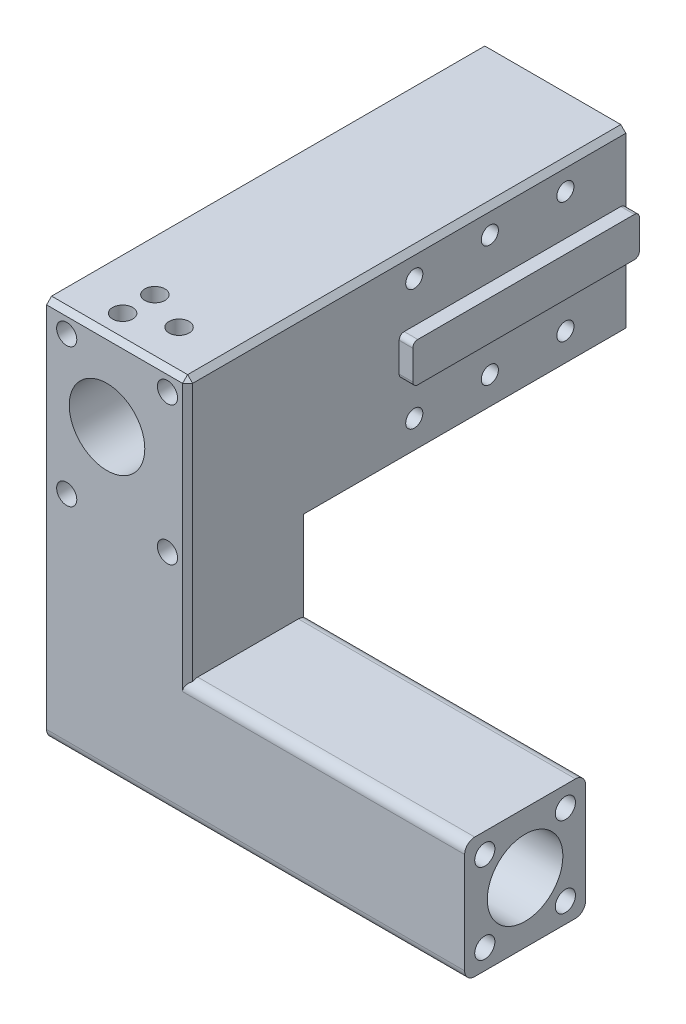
SolidWorks part; units mm, degrees
ref_plane "Ebene vorne" through (0, 0, 0) normal (0, 0, 1) x (1, 0, 0)
ref_plane "Ebene oben" through (0, 0, 0) normal (0, 1, 0) x (1, 0, 0)
ref_plane "Ebene rechts" through (0, 0, 0) normal (1, 0, 0) x (0, 0, -1)
sketch "Skizze1" plane through (0, 0, 0) normal (0, 1, 0) x (1, 0, 0)
  line L1 (-14, -43.5) -> (14, -43.5)
  line L2 (-14, -43.5) -> (-14, 43.5)
  line L3 (-14, 43.5) -> (14, 43.5)
  line L4 (14, -43.5) -> (14, 43.5)
  line L5 (-14, -43.5) -> (14, 43.5) construction
  line L6 (-14, 43.5) -> (14, -43.5) construction
  point P0 (0, 0)
  dimension "D1" = 87
  dimension "D2" = 28
extrude "Aufsatz-Linear austragen1" add sketch "Skizze1" along normal mid plane 100.5
hole_wizard "Ø15.0 (15) Durchmesser Bohrung2" positions "Skizze4" profile "Skizze5" hole size "Ø15.0" standard "DIN"
sketch "Skizze4" plane through (14, 0, 0) normal (1, 0, 0) x (0, 0, -1)
  line L0 (-43.5, -50.25) -> (43.5, -50.25) construction
  line L1 (-43.5, 50.25) -> (-43.5, -50.25) construction
  point P0 (-31.5, -38.25)
  dimension "D1" = 12
  dimension "D2" = 12
sketch "Skizze5" plane through (14, -38.25, 31.5) normal (0, 1, 0) x (0, 0, -1)
  line L0 (0, 0) -> (0, 28)
  line L1 (0, 28) -> (7.5, 28)
  line L2 (7.5, 28) -> (7.5, 0)
  line L5 (7.5, 0) -> (0, 0)
  line L11 (0, -6.35) -> (0, 107.95) construction
  dimension "Bohrerdurchmesser" = 15
  dimension "Bohrungstiefe" = 28
hole_wizard "Ø15.0 (15) Durchmesser Bohrung1" positions "Skizze2" profile "Skizze3" hole size "Ø15.0" standard "DIN"
sketch "Skizze2" plane through (0, 0, 43.5) normal (0, 0, 1) x (1, 0, 0)
  line L0 (-14, 50.25) -> (-14, -50.25) construction
  line L1 (-14, -50.25) -> (14, -50.25) construction
  point P0 (-2, 9.75)
  dimension "D1" = 60
  dimension "D2" = 12
sketch "Skizze3" plane through (-2, 9.75, 43.5) normal (1, 0, 0) x (0, -1, 0)
  line L0 (0, 0) -> (0, 87)
  line L1 (0, 87) -> (7.5, 87)
  line L2 (7.5, 87) -> (7.5, 0)
  line L5 (7.5, 0) -> (0, 0)
  line L11 (0, -6.35) -> (0, 107.95) construction
  dimension "Bohrerdurchmesser" = 15
  dimension "Bohrungstiefe" = 87
sketch "Skizze9" plane through (0, 0, 43.5) normal (0, 0, 1) x (1, 0, 0)
  line L0 (-14, 50.25) -> (-14, -50.25) construction
  line L1 (14, 50.25) -> (4, 50.25)
  line L2 (14, 50.25) -> (14, 35.25)
  line L3 (14, 35.25) -> (4, 35.25)
  line L4 (4, 50.25) -> (4, 35.25)
  dimension "D1" = 15
  dimension "D2" = 18
extrude "Schnitt-Linear austragen1" cut sketch "Skizze9" against normal through all
sketch "Skizze11" plane through (14, 0, 0) normal (1, 0, 0) x (0, 0, -1)
  line L0 (-43.5, -50.25) -> (43.5, -50.25) construction
  line L1 (43.5, -9.75) -> (-19.5, -9.75)
  line L2 (43.5, -9.75) -> (43.5, -50.25)
  line L3 (43.5, -50.25) -> (-19.5, -50.25)
  line L4 (-19.5, -9.75) -> (-19.5, -50.25)
  line L5 (-43.5, 35.25) -> (-43.5, -50.25) construction
  line L7 (43.5, 35.25) -> (43.5, -50.25) construction
  line L8 (43.5, 50.25) -> (-43.5, 50.25) construction
  line L9 (-35.5, 50.25) -> (43.5, 50.25)
  line L10 (-35.5, 50.25) -> (-35.5, 25.75)
  line L11 (-35.5, 25.75) -> (43.5, 25.75)
  line L12 (43.5, 50.25) -> (43.5, 25.75)
  line L13 (-43.5, 50.25) -> (-43.5, 35.25) construction
  dimension "D1" = 24
  dimension "D2" = 40.5
  dimension "D3" = 24.5
  dimension "D4" = 8
extrude "Schnitt-Linear austragen3" cut sketch "Skizze11" against normal through all
hole_wizard "Stirnsenkung für M3 Zylinderschraube mit Innensechskant1" positions "Skizze12" profile "Skizze13" counterbore size "M3" standard "DIN"
sketch "Skizze12" plane through (-14, 0, 0) normal (-1, 0, 0) x (0, 0, 1)
  line L1 (-43.5, 25.75) -> (-43.5, -9.75) construction
  line L2 (35.5, 25.75) -> (-43.5, 25.75) construction
  point P0 (-31.5, -3.25)
  point P2 (-31.5, 20.75)
  point P4 (-16.5, 20.75)
  point P6 (-16.5, -3.25)
  point P8 (-1.5, -3.25)
  point P10 (-1.5, 20.75)
  dimension "D1" = 5
  dimension "D2" = 24
  dimension "D3" = 12
  dimension "D4" = 15
  dimension "D5" = 15
sketch "Skizze13" plane through (-14, -3.25, -31.5) normal (0, 1, 0) x (0, 0, 1)
  line L0 (0, 0) -> (0, 28)
  line L1 (0, 28) -> (1.7, 28)
  line L3 (1.7, 28) -> (1.7, 3.4)
  line L4 (1.7, 3.4) -> (3.25, 3.4)
  line L5 (3.25, 3.4) -> (3.25, 0)
  line L7 (3.25, 0) -> (0, 0)
  line L11 (0, -6.35) -> (0, 107.95) construction
  dimension "Bohrerdurchmesser" = 3.4
  dimension "Bohrungstiefe" = 28
  dimension "Senkdurchmesser2" = 6.5
  dimension "Senktiefe2" = 3.4
sketch "Skizze14" plane through (14, 0, 0) normal (1, 0, 0) x (0, 0, -1)
  line L0 (-19.5, -9.75) -> (-19.5, -50.25) construction
  line L1 (-43.5, -50.25) -> (-19.5, -50.25)
  line L2 (-43.5, -50.25) -> (-43.5, -26.25)
  line L3 (-43.5, -26.25) -> (-19.5, -26.25)
  line L4 (-19.5, -50.25) -> (-19.5, -26.25)
  circle A0 centre (-31.5, -38.25) radius 7.5 construction
  circle A1 centre (-31.5, -38.25) radius 7.5
  dimension "D1" = 24
extrude "Aufsatz-Linear austragen2" add sketch "Skizze14" along normal blind 55
hole_wizard "Ø4.0 (4) Durchmesser Bohrung1" positions "Skizze15" profile "Skizze16" hole size "Ø4.0" standard "DIN"
sketch "Skizze15" plane through (69, 0, 0) normal (1, 0, 0) x (0, 0, -1)
  line L0 (-19.5, -26.25) -> (-43.5, -26.25) construction
  line L1 (-43.5, -26.25) -> (-43.5, -50.25) construction
  line L2 (-19.5, -50.25) -> (-43.5, -50.25) construction
  line L3 (-19.5, -50.25) -> (-19.5, -26.25) construction
  point P0 (-39.5, -30.25)
  point P2 (-23.5, -30.25)
  point P4 (-23.5, -46.25)
  point P6 (-39.5, -46.25)
  dimension "D1" = 4
  dimension "D2" = 4
  dimension "D3" = 4
  dimension "D4" = 4
sketch "Skizze16" plane through (69, -30.25, 39.5) normal (0, 1, 0) x (0, 0, -1)
  line L0 (0, 0) -> (0, 6)
  line L1 (0, 6) -> (2, 6)
  line L2 (2, 6) -> (2, 0)
  line L5 (2, 0) -> (0, 0)
  line L10 (0, 6) -> (-2, 6) construction
  line L11 (0, -6.35) -> (0, 107.95) construction
  dimension "Bohrerdurchmesser" = 4
  dimension "Bohrungstiefe" = 6
  dimension "Spitzenwinkel" = 180
hole_wizard "Ø4.0 (4) Durchmesser Bohrung2" positions "Skizze17" profile "Skizze18" hole size "Ø4.0" standard "DIN"
sketch "Skizze17" plane through (-14, 0, 0) normal (-1, 0, 0) x (0, 0, 1)
  point P0 (39.5, -30.25)
  point P3 (23.5, -30.25)
  point P6 (23.5, -46.25)
  point P9 (39.5, -46.25)
sketch "Skizze18" plane through (-14, -30.25, 39.5) normal (0, 1, 0) x (0, 0, 1)
  line L0 (0, 0) -> (0, 6)
  line L1 (0, 6) -> (2, 6)
  line L2 (2, 6) -> (2, 0)
  line L5 (2, 0) -> (0, 0)
  line L10 (0, 6) -> (-2, 6) construction
  line L11 (0, -6.35) -> (0, 107.95) construction
  dimension "Bohrerdurchmesser" = 4
  dimension "Bohrungstiefe" = 6
  dimension "Spitzenwinkel" = 180
hole_wizard "Ø4.0 (4) Durchmesser Bohrung3" positions "Skizze19" profile "Skizze20" hole size "Ø4.0" standard "DIN"
sketch "Skizze19" plane through (0, 0, -43.5) normal (0, 0, -1) x (-1, 0, 0)
  line L0 (-14, 25.75) -> (-14, -9.75) construction
  line L1 (14, 25.75) -> (14, -9.75) construction
  line L2 (14, 25.75) -> (-14, 25.75) construction
  line L3 (14, -9.75) -> (-14, -9.75) construction
  point P0 (-10, 21.75)
  point P2 (10, 21.75)
  point P4 (10, -5.75)
  point P6 (-10, -5.75)
  dimension "D2" = 4
  dimension "D4" = 4
  dimension "D1" = 4
  dimension "D3" = 4
sketch "Skizze20" plane through (10, 21.75, -43.5) normal (1, 0, 0) x (0, 1, 0)
  line L0 (0, 0) -> (0, 6)
  line L1 (0, 6) -> (2, 6)
  line L2 (2, 6) -> (2, 0)
  line L5 (2, 0) -> (0, 0)
  line L10 (0, 6) -> (-2, 6) construction
  line L11 (0, -6.35) -> (0, 107.95) construction
  dimension "Bohrerdurchmesser" = 4
  dimension "Bohrungstiefe" = 6
  dimension "Spitzenwinkel" = 180
hole_wizard "Ø4.0 (4) Durchmesser Bohrung4" positions "Skizze21" profile "Skizze22" hole size "Ø4.0" standard "DIN"
sketch "Skizze21" plane through (0, 0, 43.5) normal (0, 0, 1) x (1, 0, 0)
  point P0 (10, 21.75)
  point P3 (-10, 21.75)
  point P6 (-10, -5.75)
  point P9 (10, -5.75)
sketch "Skizze22" plane through (10, 21.75, 43.5) normal (1, 0, 0) x (0, -1, 0)
  line L0 (0, 0) -> (0, 6)
  line L1 (0, 6) -> (2, 6)
  line L2 (2, 6) -> (2, 0)
  line L5 (2, 0) -> (0, 0)
  line L10 (0, 6) -> (-2, 6) construction
  line L11 (0, -6.35) -> (0, 107.95) construction
  dimension "Bohrerdurchmesser" = 4
  dimension "Bohrungstiefe" = 6
  dimension "Spitzenwinkel" = 180
sketch "Skizze23" plane through (14, 0, 0) normal (1, 0, 0) x (0, 0, -1)
  line L0 (43.5, 25.75) -> (43.5, -9.75) construction
  line L1 (-1.5, 12.65) -> (43.5, 12.65)
  line L2 (-1.5, 12.65) -> (-1.5, 4.85)
  line L3 (-1.5, 4.85) -> (43.5, 4.85)
  line L4 (43.5, 12.65) -> (43.5, 4.85)
  circle A0 centre (31.5, -3.25) radius 1.7 construction
  circle A1 centre (31.5, 20.75) radius 1.7 construction
  dimension "D1" = 8.1
  dimension "D2" = 8.1
  dimension "D3" = 45
extrude "Aufsatz-Linear austragen3" add sketch "Skizze23" along normal blind 2.7
fillet "Verrundung1" radius 1 4 edges at (15.35, 12.65, -43.5) (15.35, 4.85, -43.5) (15.35, 12.65, 1.5) (15.35, 4.85, 1.5)
fillet "Verrundung2" radius 2 4 edges at (27.5, -50.25, 43.5) (27.5, -50.25, 19.5) (41.5, -26.25, 19.5) (41.5, -26.25, 43.5)
sketch "Skizze24" plane through (14, 0, 0) normal (1, 0, 0) x (0, 0, -1)
  line L1 (-35.5, 25.75) -> (-43.5, 25.75)
  line L2 (-35.5, 25.75) -> (-35.5, 50.25)
  line L3 (-35.5, 50.25) -> (-43.5, 50.25)
  line L4 (-43.5, 25.75) -> (-43.5, 50.25)
extrude "Schnitt-Linear austragen4" cut sketch "Skizze24" against normal through all
chamfer "Fase1" distance 1 angle 45 5 edges at (14, -19, 19.5) (14, -1.25, 43.5) (14, 25.75, 0) (14, -9.75, -12) (0, 25.75, 43.5)
hole_wizard "Ø4.0 (4) Durchmesser Bohrung5" positions "Skizze25" profile "Skizze26" hole size "Ø4.0" standard "DIN"
sketch "Skizze25" plane through (0, 25.75, 0) normal (0, 1, 0) x (1, 0, 0)
  line L0 (14, 43.5) -> (14, -42.5) construction
  line L1 (13, -43.5) -> (-14, -43.5) construction
  line L2 (-4, -38.4) -> (-4, -32) construction
  line L4 (-4, -35.2) -> (4, -35.2) construction
  point P0 (-4, -32)
  point P2 (4, -35.2)
  point P9 (-4, -38.4)
  dimension "D1" = 8
  dimension "D2" = 10
  dimension "D3" = 8.3
  dimension "D4" = 6.4
sketch "Skizze26" plane through (-4, 25.75, 32) normal (1, 0, 0) x (0, 0, 1)
  line L0 (0, 0) -> (0, 7)
  line L1 (0, 7) -> (2, 7)
  line L2 (2, 7) -> (2, 0)
  line L5 (2, 0) -> (0, 0)
  line L10 (0, 7) -> (-2, 7) construction
  line L11 (0, -6.35) -> (0, 107.95) construction
  dimension "Bohrerdurchmesser" = 4
  dimension "Bohrungstiefe" = 7
  dimension "Spitzenwinkel" = 180
